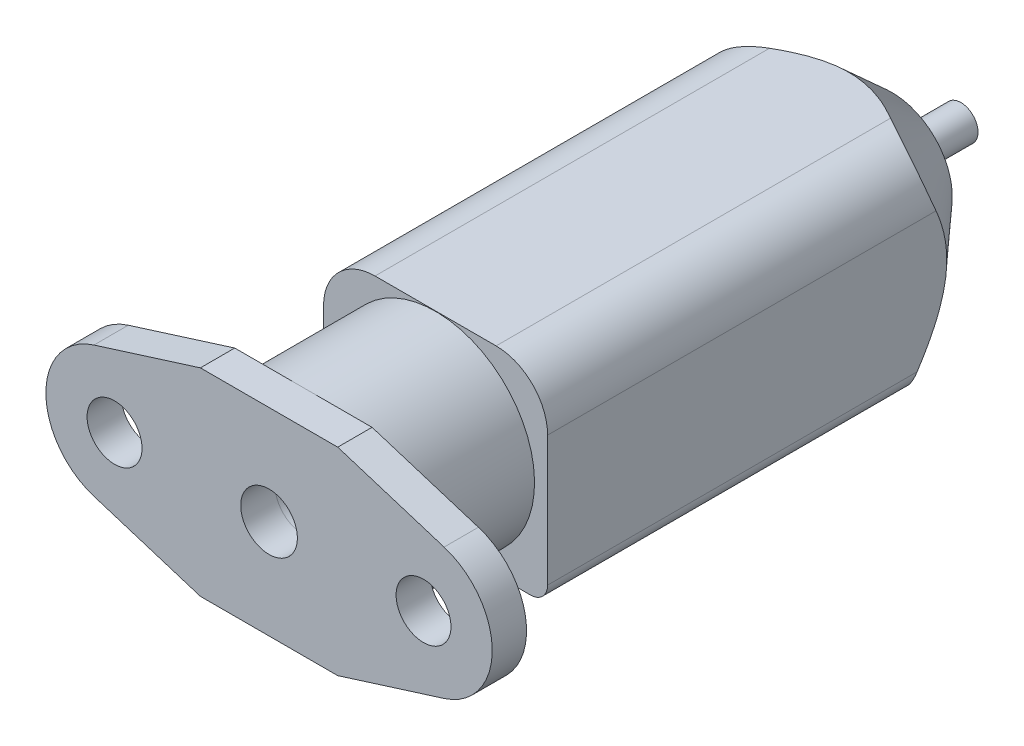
SolidWorks part; units mm, degrees
ref_plane "Alzado" through (0, 0, 0) normal (0, 0, 1) x (1, 0, 0)
ref_plane "Planta" through (0, 0, 0) normal (0, 1, 0) x (1, 0, 0)
ref_plane "Vista lateral" through (0, 0, 0) normal (1, 0, 0) x (0, 0, -1)
sketch "Croquis1" plane through (0, 0, 0) normal (0, 0, 1) x (1, 0, 0)
  line L0 (4, 5.763) -> (10.196, 3.8191)
  line L1 (-4, 5.763) -> (-10.1991, 3.8155)
  line L2 (-4, -5.765) -> (-10.1991, -3.8177)
  line L3 (4, -5.765) -> (10.1978, -3.8173)
  line L4 (4, -5.765) -> (-4, -5.765)
  line L5 (-4, 5.763) -> (4, 5.763)
  circle A0 centre (8.998, 0.0006) radius 1.5982
  circle A1 centre (-9.0001, -0.0011) radius 1.601
  circle A2 centre (0, 0) radius 1.6509
  arc A3 (10.1978, -3.8173) -> (10.196, 3.8191) centre (8.998, 0.0006) ccw
  arc A4 (-10.1991, 3.8155) -> (-10.1991, -3.8177) centre (-9.0001, -0.0011) ccw
extrude "Saliente-Extruir7" add sketch "Croquis1" against normal blind 2 separate body
sketch "Croquis2" plane through (0, 0, -2) normal (0, 0, -1) x (-1, 0, 0)
  circle A0 centre (0, 0) radius 5.765
  circle A1 centre (0, 0) radius 1.6512
extrude "Saliente-Extruir8" add sketch "Croquis2" along normal blind 7.7
sketch "Croquis3" plane through (0, 0, -9.7) normal (0, 0, -1) x (-1, 0, 0)
  line L1 (3.5269, 5.7838) -> (-3.5269, 5.7838)
  line L2 (6.5269, 2.7838) -> (6.5269, -4.7838)
  line L3 (5.5269, -5.7838) -> (-5.5269, -5.7838)
  line L4 (-6.5269, 2.7838) -> (-6.5269, -4.7838)
  line L5 (6.5269, 5.7838) -> (-6.5269, -5.7838) construction
  line L6 (6.5269, -5.7838) -> (-6.5269, 5.7838) construction
  arc A0 (-3.5269, 5.7838) -> (-6.5269, 2.7838) centre (-3.5269, 2.7838) ccw
  arc A1 (3.5269, 5.7838) -> (6.5269, 2.7838) centre (3.5269, 2.7838) cw
  arc A2 (-5.5269, -5.7838) -> (-6.5269, -4.7838) centre (-5.5269, -4.7838) cw
  arc A3 (6.5269, -4.7838) -> (5.5269, -5.7838) centre (5.5269, -4.7838) cw
  point P0 (0, 0)
  dimension "D1" = 3
  dimension "D2" = 1
extrude "Saliente-Extruir9" add sketch "Croquis3" along normal blind 26.6
ref_plane "Plano1" through (0, 5.765, 0) normal (0, 1, 0) x (1, 0, 0)
ref_axis "Eje1" through (0, 0, -44.835) along (0, 0, 1)
sketch "Croquis5" plane through (0, 0, 0) normal (0, 1, 0) x (1, 0, 0)
  line L0 (0, 36.3) -> (-3.5, 36.3) construction
  line L1 (-3.5269, 36.3) -> (3.5269, 36.3) construction
  line L2 (-3.5, 36.3) -> (-8.4726, 30.8035)
  line L3 (-3.5, 36.3) -> (-8.4726, 36.3)
  line L4 (-8.4726, 30.8035) -> (-8.4726, 36.3)
revolve "Cortar-Revolución1" cut sketch "Croquis5" angle 360 about axis through (0, 0, -44.835) along (0, 0, 1)
sketch "Croquis6" plane through (0, 0, -36.3) normal (0, 0, -1) x (-1, 0, 0)
  circle A0 centre (0, 0) radius 0.9994
extrude "Saliente-Extruir10" add sketch "Croquis6" along normal blind 4
